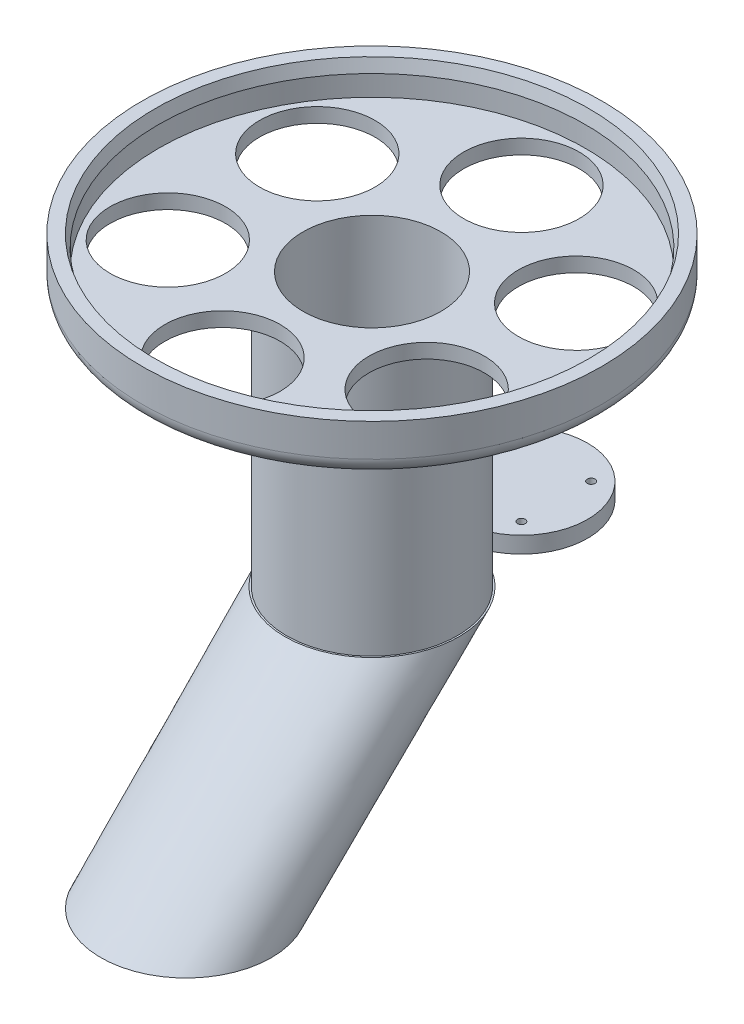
SolidWorks part; units mm, degrees
ref_plane "Front Plane" through (0, 0, 0) normal (0, 0, 1) x (1, 0, 0)
ref_plane "Top Plane" through (0, 0, 0) normal (0, 1, 0) x (1, 0, 0)
ref_plane "Right Plane" through (0, 0, 0) normal (1, 0, 0) x (0, 0, -1)
sketch "Sketch1" plane through (0, 0, 0) normal (0, 0, 1) x (1, 0, 0)
  line L0 (0, 0) -> (0, 32.6373) construction
  line L1 (0, 0) -> (-65, 0)
  line L2 (-65, 0) -> (-65, -10)
  line L3 (-65, -10) -> (-21, -10)
  line L4 (-21, -10) -> (-21, -93.02)
  line L5 (-21, -93.02) -> (0, -93.02)
  line L6 (0, -93.02) -> (0, 0)
  dimension "D1" = 21
  dimension "D2" = 10
  dimension "D3" = 44
  dimension "D4" = 83.02
revolve "Revolve1" add sketch "Sketch1" angle 360 about L0
shell "Shell1" thickness 5
chamfer "Chamfer2" distance 1 angle 75 1 edges at (65, 0, 0)
sketch "Sketch4" plane through (0, -10, 0) normal (0, 1, 0) x (1, 0, 0)
  line L0 (0, 26) -> (0, 65) construction
  circle A1 centre (0, 0) radius 65 construction
  circle A2 centre (0, 0) radius 45.5 construction
  circle A3 centre (0, 45.5) radius 17.59
  circle A6 centre (0, 0) radius 26 construction
  point P10 (0, 45.5)
  dimension "D1" = 35.18
extrude "Cut-Extrude1" cut sketch "Sketch4" against normal up to surface (5 mm away)
pattern_circular "CirPattern1" count 6 over 360 about axis through (0, 0, 0) along (0, 1, 0) of "Cut-Extrude1"
chamfer "Chamfer3" distance 1 angle 30 6 edges at (-17.59, -15, -45.5) (-17.59, -15, 45.5) (21.8142, -15, 22.75) (21.8142, -15, -22.75) (-56.9942, -15, 22.75) (-56.9942, -15, -22.75)
fillet "Fillet1" radius 5 1 edges at (-70, -15, 0)
fillet "Fillet2" radius 0.5 1 edges at (-26, -15, 0)
ref_plane "Plane1" through (0, -93.02, 0) normal (0, -1, 0) x (-1, 0, 0)
sketch "Sketch5" plane through (0, -93.02, 0) normal (0, -1, 0) x (-1, 0, 0)
  circle A0 centre (0, 45.5) radius 20.14
  circle A1 centre (0, 45.5) radius 20.14
  circle A2 centre (0, 45.5) radius 18.59 construction
  dimension "D1" = 40.28
sketch "Sketch6" plane through (0, -93.02, 0) normal (0, -1, 0) x (1, 0, 0)
  circle A1 centre (0, 0) radius 21
  circle A2 centre (0, 0) radius 21 construction
extrude "Boss-Extrude1" add sketch "Sketch5" against normal blind 5 contours A0
chamfer "Chamfer1" distance 2.5 angle 75 1 edges at (21, -93.02, 0)
sketch "Sketch9" plane through (0, -88.02, 0) normal (0, 1, 0) x (1, 0, 0)
  circle A0 centre (0, 45.5) radius 20.14
  arc A1 (3.7973, 25.7212) -> (-3.7973, 25.7212) centre (0, 45.5) ccw construction
extrude "Cut-Extrude4" cut sketch "Sketch9" along normal up to surface (73.02 mm away)
sketch "Sketch10" plane through (0, -93.02, 0) normal (0, -1, 0) x (1, 0, 0)
  line L1 (-10.6066, -56.1066) -> (10.6066, -56.1066) construction
  line L2 (-10.6066, -56.1066) -> (-10.6066, -34.8934) construction
  line L3 (-10.6066, -34.8934) -> (10.6066, -34.8934) construction
  line L4 (10.6066, -56.1066) -> (10.6066, -34.8934) construction
  line L5 (-10.6066, -56.1066) -> (10.6066, -34.8934) construction
  line L6 (-10.6066, -34.8934) -> (10.6066, -56.1066) construction
  circle A0 centre (0, -45.5) radius 15 construction
  dimension "D1" = 30
hole_wizard "Ø1.0mm Dowel Hole1" positions "Sketch11" profile "Sketch12" hole size "Ø1.0" standard "ANSI Metric"
sketch "Sketch11" plane through (0, -93.02, 0) normal (0, -1, 0) x (-1, 0, 0)
  point P0 (-10.6066, 56.1066)
  point P3 (10.6066, 56.1066)
  point P6 (10.6066, 34.8934)
  point P9 (-10.6066, 34.8934)
sketch "Sketch12" plane through (10.6066, -93.02, -56.1066) normal (1, 0, 0) x (0, 0, -1)
  line L0 (0, 0) -> (0, 5)
  line L1 (0, 5) -> (1.175, 5)
  line L2 (1.175, 5) -> (1.175, 0)
  line L5 (1.175, 0) -> (0, 0)
  line L11 (0, -6.35) -> (0, 107.95) construction
  dimension "Thru Hole Dia." = 2.35
  dimension "Thru Hole Depth" = 5
sketch "Sketch13" plane through (0, 0, 0) normal (1, 0, 0) x (0, 0, -1)
  line L7 (0, -93.02) -> (-69.7034, -162.7234) construction
  line L8 (-26, -93.02) -> (25.7212, -93.02) construction
  line L9 (0, -93.02) -> (-26, -93.02) construction
  line L10 (-26, -93.02) -> (-82.5685, -149.5885) construction
  line L11 (-82.5685, -149.5885) -> (-56.5685, -149.5885) construction
  line L12 (0, -93.02) -> (-56.5685, -149.5885) construction
  dimension "D1" = 45
  dimension "D2" = 80
ref_plane "Plane2" through (0, -149.5885, 0) normal (0, -1, 0) x (-1, 0, 0)
sketch "Sketch14" plane through (0, -149.5885, 0) normal (0, -1, 0) x (-1, 0, 0)
  circle A0 centre (0, -56.5685) radius 26
sketch "Sketch15" plane through (0, -93.02, 0) normal (0, -1, 0) x (1, 0, 0)
  circle A0 centre (0, 0) radius 26.5
loft "Loft3" add profiles "Sketch15", "Sketch14"
sketch "Sketch18" plane through (0, -149.5885, 0) normal (0, -1, 0) x (1, 0, 0)
  circle A2 centre (0, 56.5685) radius 21
  circle A3 centre (0, 56.5685) radius 21
  dimension "D1" = 5
loft "Cut-Loft1" cut profiles "Sketch18", "Sketch6"
